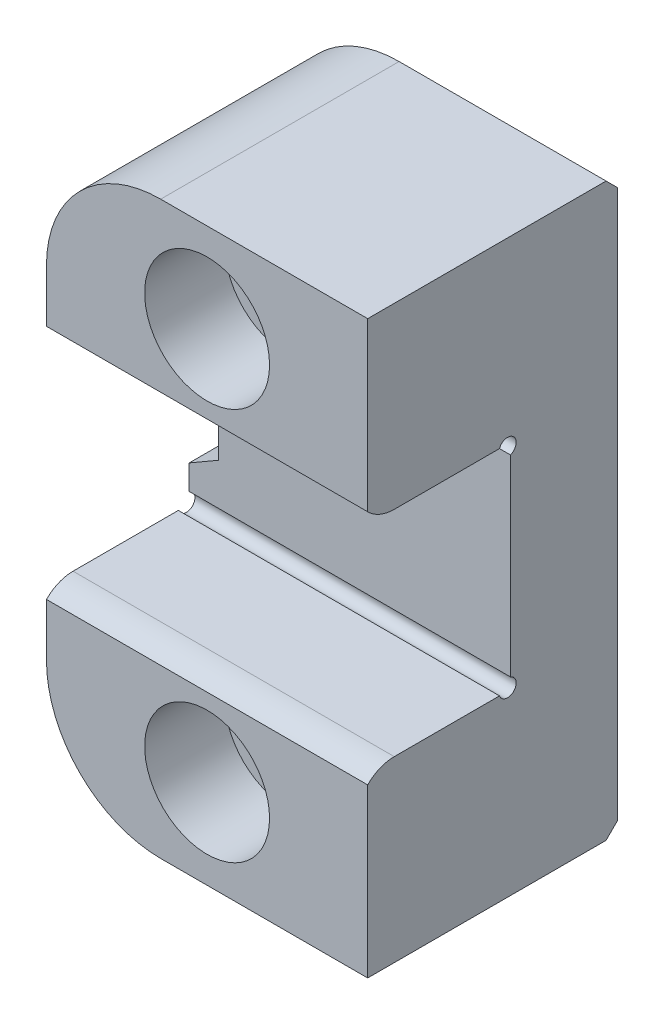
SolidWorks part; units mm, degrees
ref_plane "Front Plane" through (0, 0, 0) normal (0, 0, 1) x (1, 0, 0)
ref_plane "Top Plane" through (0, 0, 0) normal (0, 1, 0) x (1, 0, 0)
ref_plane "Right Plane" through (0, 0, 0) normal (1, 0, 0) x (0, 0, -1)
sketch "Sketch1" plane through (0, 0, 0) normal (1, 0, 0) x (0, 0, -1)
  line L0 (0, 0) -> (50000, 0) construction
  line L1 (0, 9.525) -> (12.7, 9.525)
  line L2 (0, 25.4) -> (22.225, 25.4)
  line L3 (0, 25.4) -> (0, 9.525)
  line L4 (0, -25.4) -> (22.225, -25.4)
  line L5 (22.225, 25.4) -> (22.225, -25.4)
  line L6 (12.7, 9.525) -> (12.7, -9.525)
  line L7 (12.7, -9.525) -> (0, -9.525)
  line L9 (0, 13.97) -> (0, -13.97) construction
  line L10 (0, -9.525) -> (0, -25.4)
  dimension "D1" = 22.225
  dimension "D2" = 50.8
  dimension "D3" = 12.7
  dimension "D4" = 19.05
extrude "Extrude1" add sketch "Sketch1" along normal mid plane 28.575
fillet "Fillet1" radius 10.16 2 edges at (-14.2875, -25.4, -11.1125) (-14.2875, 25.4, -11.1125)
sketch "Sketch2" plane through (-7.9375, 0, -22.225) normal (0, 0, 1) x (1, 0, 0)
  line L0 (0, 0) -> (50000, 0) construction
  line L1 (22.225, -25.4) -> (22.225, 25.4) construction
  line L2 (20.6375, 5.4335) -> (23.8125, 7.2665) construction
  line L3 (20.6375, 5.4335) -> (20.6375, -5.4335) construction
  line L4 (20.6375, -5.4335) -> (23.8125, -7.2665) construction
  line L5 (23.8125, 7.2665) -> (23.8125, -7.2665) construction
  line L6 (7.9375, 0) -> (7.9375, 50000) construction
  line L7 (-7.9375, 7.2665) -> (-7.9375, -7.2665)
  line L8 (-4.7625, -5.4335) -> (-7.9375, -7.2665)
  line L9 (-4.7625, 5.4335) -> (-4.7625, -5.4335)
  line L10 (-4.7625, 5.4335) -> (-7.9375, 7.2665)
  point P4 (22.225, 6.35)
  point P10 (22.225, -6.35)
  point P13 (-6.35, -6.35)
  point P14 (-6.35, 6.35)
  dimension "D1" = 12.7
  dimension "D2" = 1.5875
  dimension "D3" = 30
  dimension "D4" = 3.175
extrude "Cut-Extrude1" cut sketch "Sketch2" along normal through all
sketch "Sketch5" plane through (14.2875, 0, 0) normal (1, 0, 0) x (0, 0, -1)
  line L0 (0, 0) -> (50000, 0) construction
  line L1 (0, 9.525) -> (12.7, 9.525) construction
  line L2 (0, 25.4) -> (0, 9.525) construction
  line L3 (0, -9.525) -> (0, -25.4) construction
  line L4 (-3.9878, -7.346) -> (2.3622, -7.346)
  line L5 (-3.9878, -7.346) -> (-3.9878, -10.521)
  line L6 (-3.9878, -10.521) -> (0, -10.521)
  line L7 (2.3622, -7.346) -> (2.3622, -9.525)
  line L8 (12.7, -9.525) -> (0, -9.525) construction
  line L9 (2.3622, 7.346) -> (2.3622, 9.525)
  line L10 (-3.9878, 10.521) -> (0, 10.521)
  line L11 (-3.9878, 7.346) -> (-3.9878, 10.521)
  line L12 (-3.9878, 7.346) -> (2.3622, 7.346)
  arc A0 (0.5438, -9.7909) -> (2.3622, -9.525) centre (2.3622, -15.875) cw construction
  arc A1 (0, -10.521) -> (0.5438, -9.7909) centre (0.762, -10.521) cw construction
  arc A2 (0, 10.521) -> (0.5438, 9.7909) centre (0.762, 10.521) ccw construction
  arc A3 (0.5438, 9.7909) -> (2.3622, 9.525) centre (2.3622, 15.875) ccw construction
  arc A4 (0, 10.521) -> (2.3622, 9.525) centre (2.3622, 12.8242) ccw
  arc A5 (0, -10.521) -> (2.3622, -9.525) centre (2.3622, -12.8242) cw
  dimension "D1" = 0.762
  dimension "D2" = 6.35
  dimension "D3" = 3.175
  dimension "D4" = 6.35
  dimension "D5" = 2.3622
extrude "Cut-Extrude2" cut sketch "Sketch5" against normal through all
sketch "Sketch6" plane through (14.2875, 0, 0) normal (1, 0, 0) x (0, 0, -1)
  line L0 (0, 0) -> (50000, 0) construction
  line L3 (12.7, 9.525) -> (12.7, -9.525) construction
  line L4 (2.3622, 9.525) -> (12.7, 9.525) construction
  circle A0 centre (12.446, 9.271) radius 0.762
  circle A1 centre (12.446, -9.271) radius 0.762
  dimension "D2" = 0.508
  dimension "D3" = 0.762
  dimension "D1" = 0.508
extrude "Cut-Extrude3" cut sketch "Sketch6" against normal through all
hole_wizard "1/4\"-20 CBORE" positions "Sketch4" profile "Sketch3" counterbore size "1/4" standard "Ansi Inch"
sketch "Sketch4" plane through (0, 0, 0) normal (0, 0, 1) x (1, 0, 0)
  line L0 (0, 0) -> (0, 50000) construction
  line L1 (0, 0) -> (50000, 0) construction
  point P0 (0, 17.4625)
  point P12 (0, -17.4625)
  dimension "D1" = 34.925
sketch "Sketch3" plane through (0, 17.4625, 0) normal (1, 0, 0) x (0, -1, 0)
  line L0 (0, 0) -> (0, 22.225)
  line L1 (0, 22.225) -> (3.5712, 22.225)
  line L3 (3.5712, 22.225) -> (3.5712, 7.1437)
  line L4 (3.5712, 7.1437) -> (5.5562, 7.1437)
  line L5 (5.5562, 7.1437) -> (5.5562, 0)
  line L7 (5.5562, 0) -> (0, 0)
  line L11 (0, -6.35) -> (0, 107.95) construction
  dimension "Thru Hole Dia." = 7.1425
  dimension "Thru Hole Depth" = 22.225
  dimension "C'Bore Dia." = 11.1125
  dimension "C'Bore Depth" = 7.1437
chamfer "Chamfer3" distance 3.81 angle 15 1 edges at (-12.7, 0, -12.7)
chamfer "Chamfer1" distance 1.016 angle 45 6 edges at (-14.2875, -10.795, -22.225) (-11.3117, -22.4242, -22.225) (5.08, -25.4, -22.225) (5.08, 25.4, -22.225) (-14.2875, 10.795, -22.225) (-11.3117, 22.4242, -22.225)
